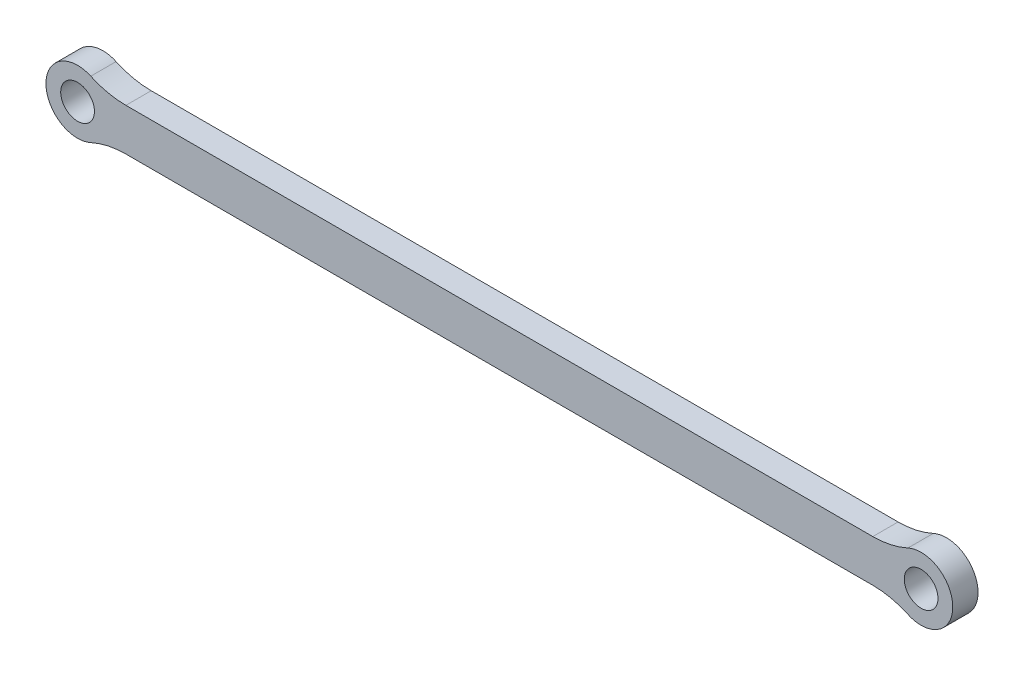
SolidWorks part; units mm, degrees
ref_plane "Alzado" through (0, 0, 0) normal (0, 0, 1) x (1, 0, 0)
ref_plane "Planta" through (0, 0, 0) normal (0, 1, 0) x (1, 0, 0)
ref_plane "Vista lateral" through (0, 0, 0) normal (1, 0, 0) x (0, 0, -1)
sketch "Croquis1" plane through (0, 0, 0) normal (0, 0, 1) x (1, 0, 0)
  line L0 (-100, 0) -> (100, 0) construction
  line L1 (0, 0) -> (0, 50000) construction
  line L2 (-88.5436, 5) -> (88.5436, 5)
  line L3 (-88.5436, -5) -> (88.5436, -5)
  circle A0 centre (-100, 0) radius 4
  circle A1 centre (100, 0) radius 4
  arc A2 (96.8755, -6.8182) -> (96.8755, 6.8182) centre (100, 0) ccw
  arc A3 (-96.8755, 6.8182) -> (-96.8755, -6.8182) centre (-100, 0) ccw
  arc A4 (-96.8755, 6.8182) -> (-88.5436, 5) centre (-88.5436, 25) ccw
  arc A5 (-96.8755, -6.8182) -> (-88.5436, -5) centre (-88.5436, -25) cw
  arc A6 (96.8755, -6.8182) -> (88.5436, -5) centre (88.5436, -25) ccw
  arc A7 (96.8755, 6.8182) -> (88.5436, 5) centre (88.5436, 25) cw
  dimension "D2" = 8
  dimension "D3" = 15
  dimension "D5" = 20
  dimension "D1" = 200
  dimension "D4" = 5
extrude "Saliente-Extruir1" add sketch "Croquis1" along normal mid plane 6
